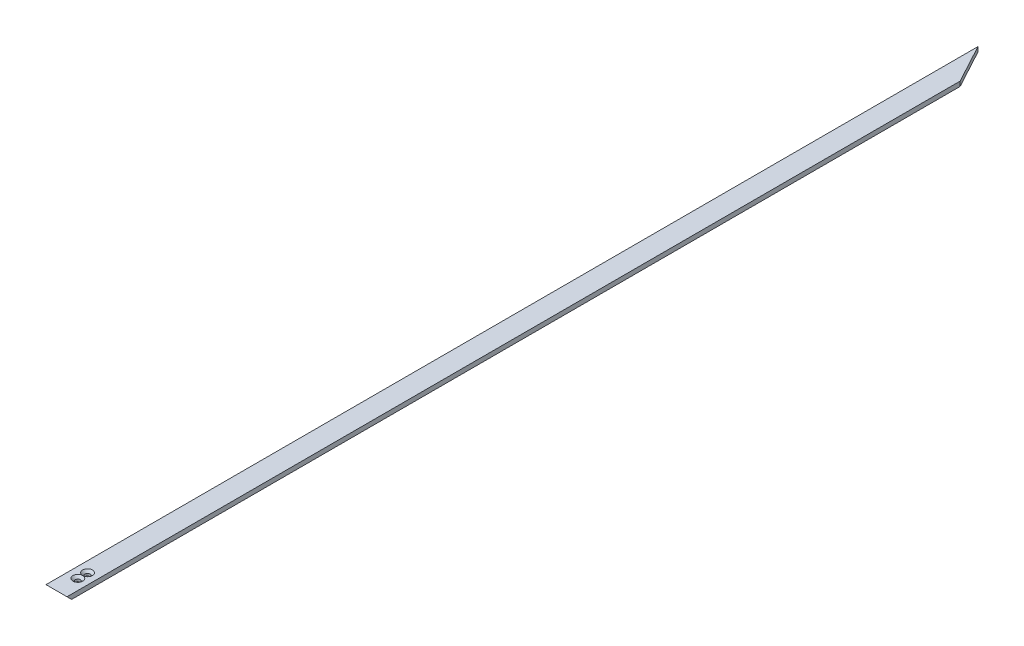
SolidWorks part; units mm, degrees
ref_plane "Plan de face" through (0, 0, 0) normal (0, 0, 1) x (1, 0, 0)
ref_plane "Plan de dessus" through (0, 0, 0) normal (0, 1, 0) x (1, 0, 0)
ref_plane "Plan de droite" through (0, 0, 0) normal (1, 0, 0) x (0, 0, -1)
sketch "Esquisse1" plane through (0, 0, 0) normal (0, 0, 1) x (1, 0, 0)
  line L1 (-13.5, 0) -> (13.5, 0)
  line L2 (-13.5, 0) -> (-13.5, 6)
  line L3 (-13.5, 6) -> (13.5, 6)
  line L4 (13.5, 0) -> (13.5, 6)
  point P4 (0, 0)
  dimension "D1" = 27
  dimension "D2" = 6
extrude "Extrusion1" add sketch "Esquisse1" along normal mid plane 1200
chamfer "Chanfrein1" distance 6 angle 45 1 edges at (0, 0, 600)
chamfer "Chanfrein2" distance 27 distance2 50 1 edges at (13.5, 3, -600)
hole_wizard "Fraisage pour vis à tête fraisée M61" positions "Esquisse3" profile "Esquisse2" countersink size "M6" standard "ISO"
sketch "Esquisse3" plane through (0, 6, 0) normal (0, 1, 0) x (-1, 0, 0)
  line L0 (-13.5, 600) -> (13.5, 600) construction
  line L1 (-13.5, 600) -> (-13.5, -550) construction
  point P0 (0, 572.5)
  point P6 (0, 560)
  dimension "D1" = 27.5
  dimension "D2" = 13.5
  dimension "D3" = 12.5
sketch "Esquisse2" plane through (0, 6, 572.5) normal (1, 0, 0) x (0, 0, 1)
  line L0 (0, 0) -> (0, 6)
  line L1 (0, 6) -> (3.25, 6)
  line L2 (3.25, 6) -> (3.25, 3.05)
  line L3 (3.25, 3.05) -> (6.3, 0)
  line L5 (6.3, 0) -> (0, 0)
  line L6 (-3.25, 3.05) -> (-6.3, 0) construction
  line L11 (0, -6.35) -> (0, 107.95) construction
  dimension "Diamètre du perçage jusqu'au prochain" = 6.5
  dimension "Profondeur du perçage jusqu'au prochain" = 6
  dimension "Diamètre du fraisage entrant" = 12.6
  dimension "Angle du fraisage entrant" = 90
